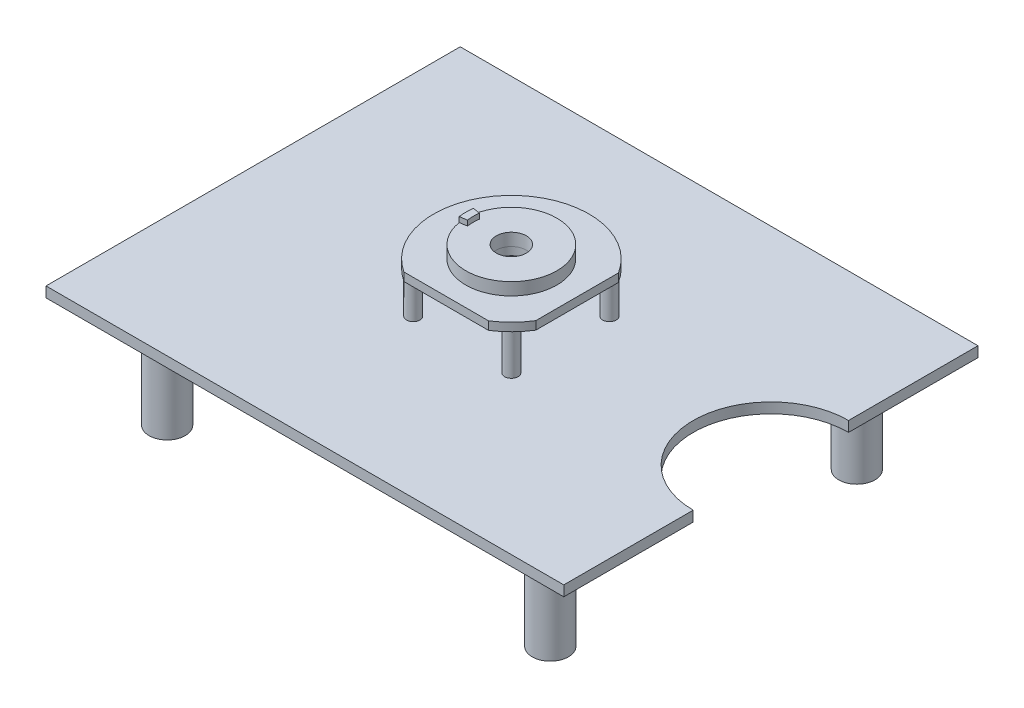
SolidWorks part; units mm, degrees
ref_plane "Front Plane" through (0, 0, 0) normal (0, 0, 1) x (1, 0, 0)
ref_plane "Top Plane" through (0, 0, 0) normal (0, 1, 0) x (1, 0, 0)
ref_plane "Right Plane" through (0, 0, 0) normal (1, 0, 0) x (0, 0, -1)
imported_body "Imported1"
sketch "Sketch1" plane through (0, 58, 0) normal (0, 1, 0) x (1, 0, 0)
  line L0 (0, 0) -> (0, -161.0277) construction
  line L1 (-50.8, -63.5) -> (50.8, -63.5)
  line L2 (-50.8, -63.5) -> (-50.8, -114.3)
  line L3 (-50.8, -114.3) -> (50.8, -114.3)
  line L4 (50.8, -63.5) -> (50.8, -114.3)
  line L5 (63.5, 50.8) -> (114.3, 50.8)
  line L6 (63.5, 50.8) -> (63.5, -50.8)
  line L7 (63.5, -50.8) -> (114.3, -50.8)
  line L8 (114.3, 50.8) -> (114.3, -50.8)
  line L9 (0, 0) -> (180.4667, 0) construction
  dimension "D1" = 63.5
  dimension "D2" = 50.8
  dimension "D3" = 101.6
  dimension "D4" = 63.5
  dimension "D5" = 101.6
  dimension "D6" = 50.8
extrude "Cut-Extrude1" cut sketch "Sketch1" against normal up to surface (8 mm away)
ref_plane "Plane1" through (0, 0, -22.25) normal (0, 0, 1) x (1, 0, 0)
sketch "S1" plane through (0, 0, -22.25) normal (0, 0, 1) x (1, 0, 0)
  spline S0 degree 3 poles (278.0107, 192.8396) (322.3633, 163.8026) (299.1272, 87.9521) (287.4302, 13.8977) (308.8654, -18.6178) knots 0 0 0 0 0.527827 1 1 1 1
sketch "Sketch2" plane through (0, 10, 0) normal (0, 1, 0) x (1, 0, 0)
  line L0 (250, -200) -> (250, 200) construction
  circle A0 centre (250, 0) radius 75
  dimension "D1" = 150
extrude "Cut-Extrude2" cut sketch "Sketch2" against normal through all contours A0
